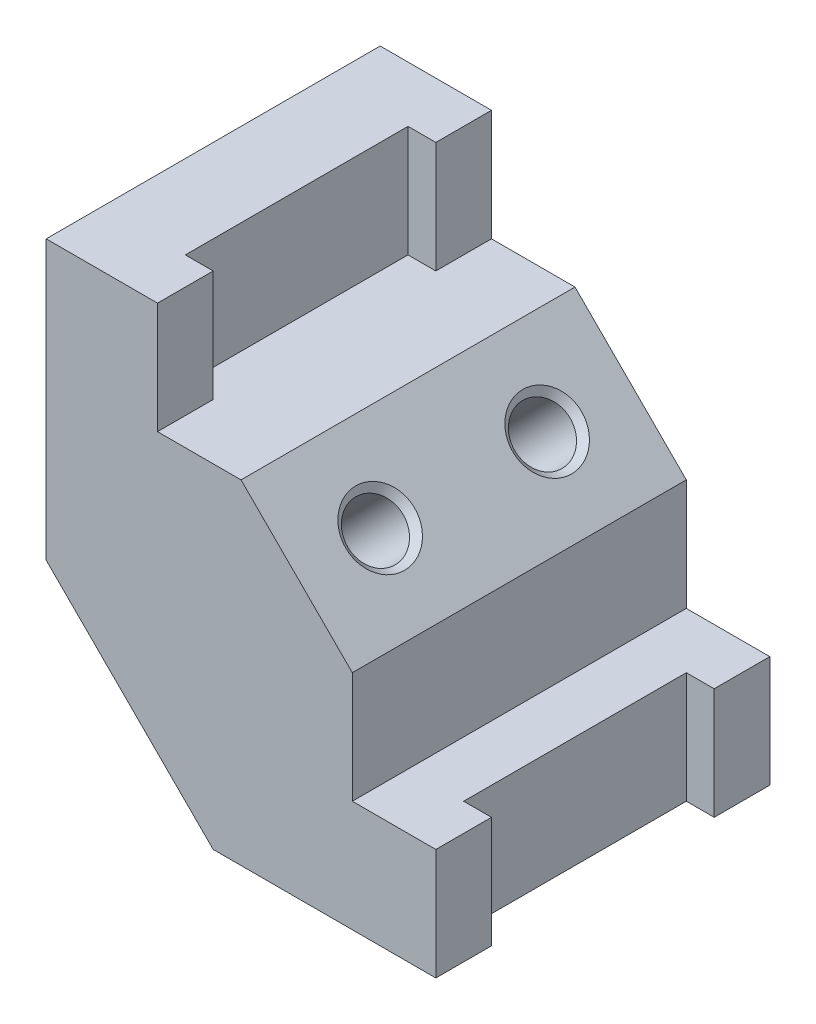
SolidWorks part; units mm, degrees
ref_plane "Front Plane" through (0, 0, 0) normal (0, 0, 1) x (1, 0, 0)
ref_plane "Top Plane" through (0, 0, 0) normal (0, 1, 0) x (1, 0, 0)
ref_plane "Right Plane" through (0, 0, 0) normal (1, 0, 0) x (0, 0, -1)
sketch "Sketch1" plane through (0, 0, 0) normal (0, 0, 1) x (1, 0, 0)
  line L0 (25.4, 0) -> (0, 0)
  line L1 (25.4, -25.4) -> (44.45, -25.4)
  line L2 (44.45, -25.4) -> (69.85, -50.8)
  line L3 (69.85, -50.8) -> (69.85, -76.2)
  line L4 (69.85, -76.2) -> (88.9, -76.2)
  line L5 (88.9, -76.2) -> (88.9, -101.6)
  line L6 (88.9, -101.6) -> (38.1, -101.6)
  line L7 (0, -63.5) -> (38.1, -101.6)
  line L8 (0, 0) -> (0, -63.5)
  line L9 (25.4, 0) -> (25.4, -25.4)
  dimension "D1" = 101.6
  dimension "D2" = 25.4
  dimension "D3" = 88.9
  dimension "D4" = 44.45
  dimension "D5" = 38.1
  dimension "D6" = 25.4
  dimension "D7" = 50.8
  dimension "D8" = 76.2
  dimension "D9" = 45
extrude "Boss-Extrude1" add sketch "Sketch1" along normal mid plane 76.2
sketch "Sketch2" plane through (9.525, 9.525, 0) normal (0.7071, 0.7071, 0) x (0, 0, -1)
  line L0 (0, 0) -> (0, -135.7448) construction
  line L2 (-38.1, -85.3124) -> (38.1, -85.3124) construction
  circle A0 centre (-19.05, -67.3546) radius 6.35
  circle A1 centre (19.05, -67.3546) radius 6.35
  dimension "D2" = 38.1
  dimension "D3" = 12.7
  dimension "D1" = 17.9578
extrude "Cut-Extrude1" cut sketch "Sketch2" against normal through all contours A0 | A1
sketch "Sketch4" plane through (0, 0, 0) normal (0, 1, 0) x (1, 0, 0)
  line L0 (0, 0) -> (25.4, 0) construction
  line L1 (25.4, -38.1) -> (25.4, 38.1) construction
  line L3 (19.05, -25.4) -> (19.05, 25.4)
  line L4 (19.05, -25.4) -> (25.4, -25.4)
  line L5 (25.4, -38.1) -> (25.4, 38.1) construction
  line L6 (25.4, -25.4) -> (25.4, 25.4)
  line L7 (25.4, 25.4) -> (19.05, 25.4)
  dimension "D1" = 6.35
  dimension "D2" = 50.8
extrude "Cut-Extrude2" cut sketch "Sketch4" against normal up to vertex (25.4 mm away)
sketch "Sketch5" plane through (0, -76.2, 0) normal (0, 1, 0) x (1, 0, 0)
  line L0 (69.85, 0) -> (88.9, 0) construction
  line L1 (69.85, -38.1) -> (69.85, 38.1) construction
  line L2 (88.9, -38.1) -> (88.9, 38.1) construction
  line L4 (82.55, -25.4) -> (88.9, -25.4)
  line L5 (82.55, -25.4) -> (82.55, 25.4)
  line L6 (88.9, -25.4) -> (88.9, 25.4)
  line L7 (88.9, 25.4) -> (82.55, 25.4)
  dimension "D1" = 6.35
  dimension "D2" = 50.8
extrude "Cut-Extrude3" cut sketch "Sketch5" against normal through all
chamfer "Chamfer1" distance 1.524 angle 45 2 edges at (52.6618, -33.6118, 19.05) (52.6618, -33.6118, -19.05)
